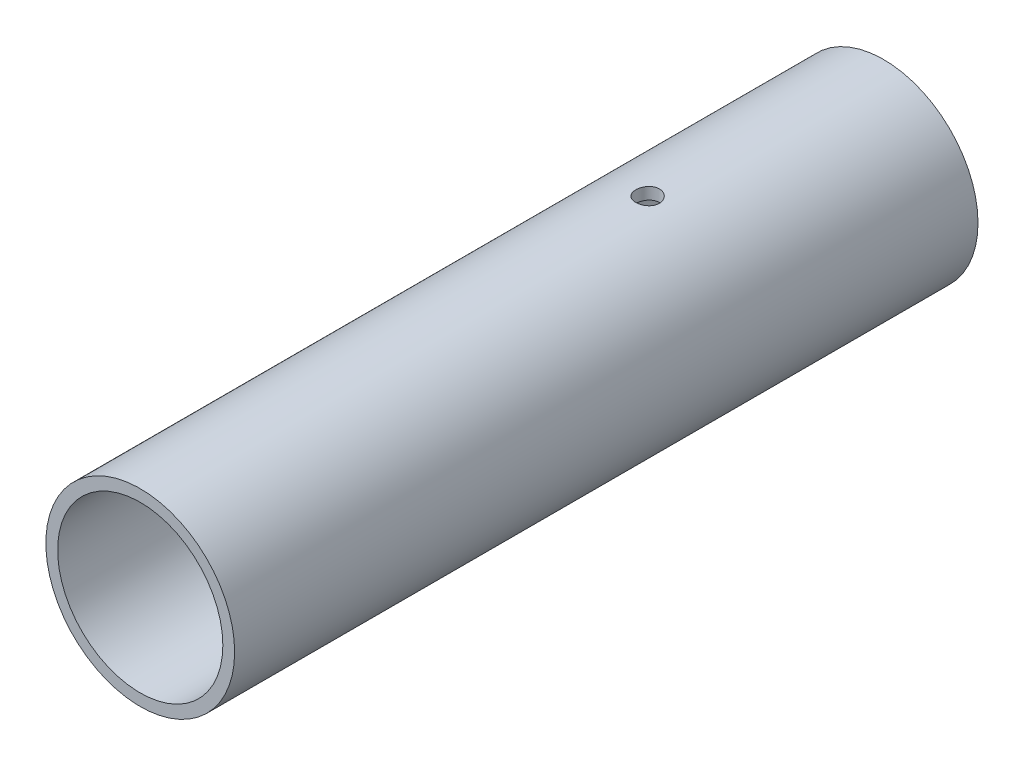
SolidWorks part; units mm, degrees
ref_plane "Plan1" through (0, 0, 0) normal (0, 0, 1) x (1, 0, 0)
ref_plane "Plan2" through (0, 0, 0) normal (0, 1, 0) x (1, 0, 0)
ref_plane "Plan3" through (0, 0, 0) normal (1, 0, 0) x (0, 0, -1)
sketch "Esquisse1" plane through (0, 0, 0) normal (0, 0, 1) x (1, 0, 0)
  circle A0 centre (0, 0) radius 8
  dimension "D1" = 16
extrude "Base-Extru.-Mince" add sketch "Esquisse1" along normal blind 63 thin
sketch "Esquisse2" plane through (0, 0, 0) normal (0, 1, 0) x (1, 0, 0)
  line L0 (0, -63) -> (0, 0) construction
  line L1 (8, 0) -> (-8, 0) construction
  circle A0 centre (0, -20) radius 1
  dimension "D1" = 2
  dimension "D2" = 20
extrude "Enlèv. mat.-Extru.1" cut sketch "Esquisse2" against normal mid plane 40
